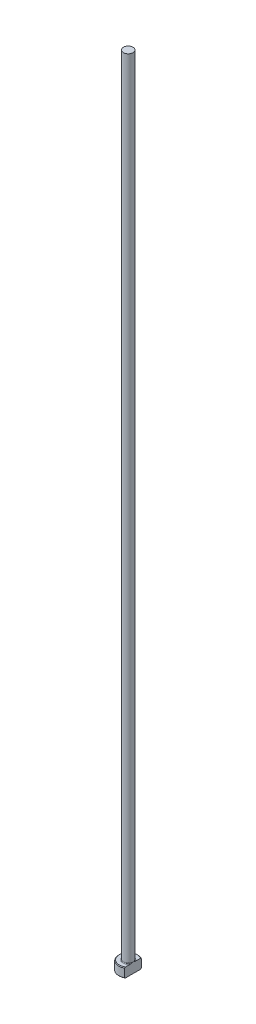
SolidWorks part; units mm, degrees
ref_plane "Front Plane" through (0, 0, 0) normal (0, 0, 1) x (1, 0, 0)
ref_plane "Top Plane" through (0, 0, 0) normal (0, 1, 0) x (1, 0, 0)
ref_plane "Right Plane" through (0, 0, 0) normal (1, 0, 0) x (0, 0, -1)
sketch "Sketch1" plane through (0, 0, 0) normal (0, 0, 1) x (1, 0, 0)
  line L0 (0, 259.9588) -> (0, -15.1925) construction
  line L1 (0, 0) -> (-3, 0)
  line L2 (-3, 0) -> (-3, 3)
  line L3 (-3, 3) -> (-1.5, 3)
  line L4 (-1.5, 3) -> (-1.5, 250)
  line L5 (-1.5, 250) -> (0, 250)
  line L6 (0, 250) -> (0, 0)
  dimension "L" = 250
  dimension "H" = 6
  dimension "T" = 3
  dimension "D" = 3
revolve "Revolve1" add sketch "Sketch1" angle 360 about L0
chamfer "Chamfer1" distance 0.2 angle 45 2 edges at (0, 3, 3) (0, 0, 3)
fillet "Fillet1" radius 0.2 1 edges at (0, 3, 1.5)
sketch "Sketch2" plane through (0, 0, 0) normal (0, 1, 0) x (1, 0, 0)
  line L0 (1.5, 2.5981) -> (1.5, -2.5981)
  circle A0 centre (0, 0) radius 3 construction
  arc A1 (1.5, -2.5981) -> (1.5, 2.5981) centre (0, 0) ccw
  circle A2 centre (0, 0) radius 1.5 construction
extrude "KEY" cut sketch "Sketch2" along normal through all
